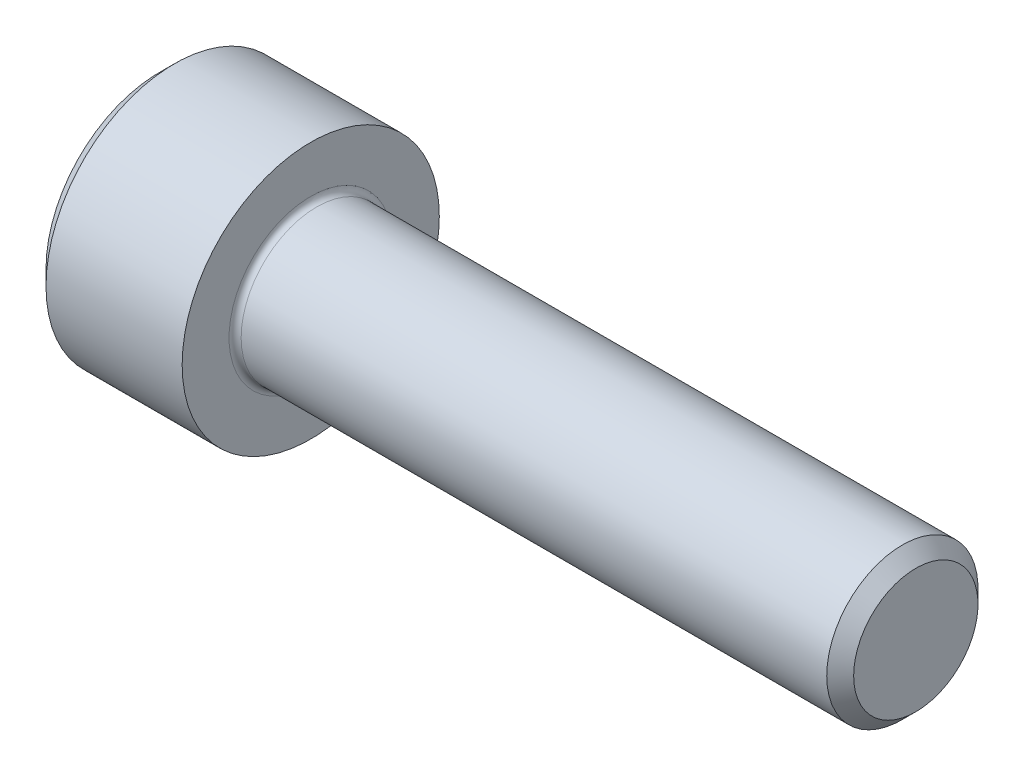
SolidWorks part; units mm, degrees
ref_plane "Plane1" through (0, 0, 0) normal (0, 0, 1) x (1, 0, 0)
ref_plane "Plane2" through (0, 0, 0) normal (0, 1, 0) x (1, 0, 0)
ref_plane "Plane3" through (0, 0, 0) normal (1, 0, 0) x (0, 0, -1)
revolve "Base-Revolve" add sketch "BodySke"
sketch "BodySke" plane through (0, 0, 0) normal (0, 0, 1) x (1, 0, 0)
  line L0 (0, 0) -> (0, 3.75)
  line L1 (0.5, 4.25) -> (5, 4.25)
  line L2 (5, 4.25) -> (5, 2.5)
  line L3 (5, 2.5) -> (24.555, 2.5)
  line L4 (25, 2.055) -> (25, 0)
  line L5 (25, 0) -> (0, 0)
  line L6 (-31.75, 0) -> (127, 0) construction
  line L7 (0, 3.75) -> (0.5, 4.25)
  line L8 (25, 2.055) -> (24.555, 2.5)
  line L9 (0, -3.75) -> (0.5, -4.25) construction
  line L10 (25, -2.055) -> (24.555, -2.5) construction
  line L11 (5.8, 9.525) -> (5.8, 3.175) construction
  line L12 (5, 9.525) -> (5, 3.175) construction
  line L13 (-25, 9.525) -> (-25, 3.175) construction
  dimension "Diameter" = 5
  dimension "Head_ht" = 5
  dimension "Length" = 20
  dimension "Body_ch_ang" = 45
  dimension "Head_dia" = 8.5
  dimension "Head_ch_ang" = 45
  dimension "Minor_dia" = 4.11
  dimension "Advance" = 0.8
  dimension "Thread_nom" = 20
  dimension "Thread_length" = 50
  dimension "Head_ch_ht" = 0.5
fillet "Fillet1" radius 0.2 1 edges at (5, 0, 2.5)
sketch "Sketch2" plane through (0, 0, 0) normal (0, 0, 1) x (1, 0, 0)
  line L0 (0, 2.042) -> (2.5, 2.042)
  line L1 (2.5, 2.042) -> (3.6789, 0)
  line L2 (-31.75, 0) -> (127, 0) construction
  line L3 (3.6789, 0) -> (0, 0)
  line L4 (0, 0) -> (0, 2.042)
  line L5 (0, 3.75) -> (0, -3.75) construction
  line L6 (0, 0) -> (47.625, 0) construction
  line L7 (5, -4.25) -> (5, 4.25) construction
  dimension "D1" = 2.042
  dimension "D2" = 60
  dimension "Wall_thickness" = 2.5
revolve "Hex-PreBroach" cut sketch "Sketch2" angle 360 about L6
sketch "Sketch3" plane through (0, 0, 0) normal (-1, 0, 0) x (0, 0.5, 0.866)
  line L0 (1.1789, 2.042) -> (-1.1789, 2.042)
  line L1 (-1.1789, 2.042) -> (-2.3579, 0)
  line L2 (1.1789, 2.042) -> (2.3579, 0)
  line L3 (1.1789, -2.042) -> (2.3579, 0)
  line L4 (1.1789, -2.042) -> (-1.1789, -2.042)
  line L5 (-1.1789, -2.042) -> (-2.3579, 0)
  dimension "D1" = 2.042
  dimension "D2" = 2.042
  dimension "Hex_size" = 4.084
extrude "Hex" cut sketch "Sketch3" against normal blind 2.5
sketch "Sketch4" plane through (0, 0, 0) normal (-1, 0, 0) x (0, 0, 1)
  line L0 (0, 0) -> (2.3876, 0)
  line L1 (0, 0) -> (6.1484, 3.5498) construction
  line L2 (0, 0) -> (1.1938, 2.0677)
  line L3 (1.9883, 0.576) -> (2.2704, 0.7389)
  line L4 (1.493, 1.4339) -> (1.7751, 1.5968)
  arc A0 (1.9883, 0.576) -> (1.493, 1.4339) centre (0, 0) ccw
  arc A1 (2.3876, 0) -> (2.2704, 0.7389) centre (0, 0) ccw
  arc A2 (1.1938, 2.0677) -> (1.7751, 1.5968) centre (0, 0) cw
  dimension "D1" = 30
  dimension "Spline_n_dim" = 4.1402
  dimension "Spline_m_dim" = 4.7752
  dimension "D2" = 60
  dimension "D3" = 0.4953
  dimension "Spline_p_dim" = 0.9906
extrude "Spline" cut sketch "Sketch4" against normal blind 2.5
pattern_circular "CirPattern1" count 6 every 60
sketch "Sketch5" plane through (0, 0, 0) normal (0, 0, 1) x (1, 0, 0)
  line L0 (-31.75, 0) -> (127, 0) construction
  line L2 (0, 3.75) -> (0, -3.75) construction
  circle A0 centre (2, 0) radius 0.675
  dimension "Drilled_hole_dia" = 1.35
  dimension "Drilled_hole_loc" = 2
extrude "Hole" cut sketch "Sketch5" against normal through all and the other way through all
pattern_circular "Drilled-4" count 2 every 60
pattern_circular "Drilled-6" count 3 every 60
sketch "ThdSchSke" plane through (0, 0, 0) normal (0, 0, 1) x (1, 0, 0)
  line L0 (5.8, -2.055) -> (5.4884, -2.5)
  line L1 (5.8, -2.055) -> (6.1116, -2.5)
  line L2 (6.1116, -2.5) -> (6.1116, -3.125)
  line L3 (-3.175, 0) -> (5.1513, 0) construction
  line L5 (6.1116, -3.125) -> (5.4884, -3.125)
  line L6 (5.4884, -3.125) -> (5.4884, -2.5)
  line L7 (0, 3.75) -> (0, -3.75) construction
  dimension "Thread_minor" = 4.11
  dimension "Diameter" = 5
  dimension "Start" = 5.8
  dimension "SideAngle" = 55
  dimension "VeeAngle" = 70
  dimension "Overcut" = 6.25
revolve "ThreadSchematic" cut sketch "ThdSchSke" angle 360 about L3
pattern_linear "ThdSchPat"
equation "\"D2@Sketch3\" = \"Hex_size@Sketch3\" / 2"
equation "\"D1@Sketch3\" = \"Hex_size@Sketch3\" / 2"
equation "\"D1@Sketch2\" = \"Hex_size@Sketch3\" / 2"
equation "\"D3@Sketch4\" = \"Spline_p_dim@Sketch4\" / 2"
equation "\"Thread_minor@ThreadCosmetic\"  =  \"Minor_dia@BodySke\""
equation "\"D2@CirPattern1\" = 360 / \"Num_teeth@CirPattern1\""
equation "\"Wall_thickness@Sketch2\" = \"Head_ht@BodySke\" - \"Key_eng@Hex\""
equation "\"Thread_length@ThreadCosmetic\" = ((sgn( (\"Length@BodySke\" - \"Advance@BodySke\" ) - \"Thread_nom@BodySke\" )-1)*( (\"Length@BodySke\" - \"Advance@BodySke\" ) - \"Thread_nom@BodySke\" ))/-2+ \"Thread_nom@BodySke\""
equation "\"Thread_minor@ThdSchSke\" = \"Minor_dia@BodySke\""
equation "\"Diameter@ThdSchSke\" = \"Diameter@BodySke\""
equation "\"Overcut@ThdSchSke\" = \"Diameter@BodySke\" * 1.25"
equation "\"Start@ThdSchSke\" = \"Head_ht@BodySke\" + \"Length@BodySke\" - \"Thread_length@ThreadCosmetic\"  '---Non-countersunk---"
equation "\"Num_threads@ThdSchPat\" = int( \"Thread_length@ThreadCosmetic\" / \"Advance@BodySke\" + 0.999 )  + 1"
equation "\"Advance@ThdSchPat\" = \"Thread_length@ThreadCosmetic\" /  (\"Num_threads@ThdSchPat\" - 1) 'relax it"
equation "\"Num_threads@ThdSchPat\" = \"Num_threads@ThdSchPat\" - sgn( \"Num_threads@ThdSchPat\" - 1) '---chamfered tips only---"
